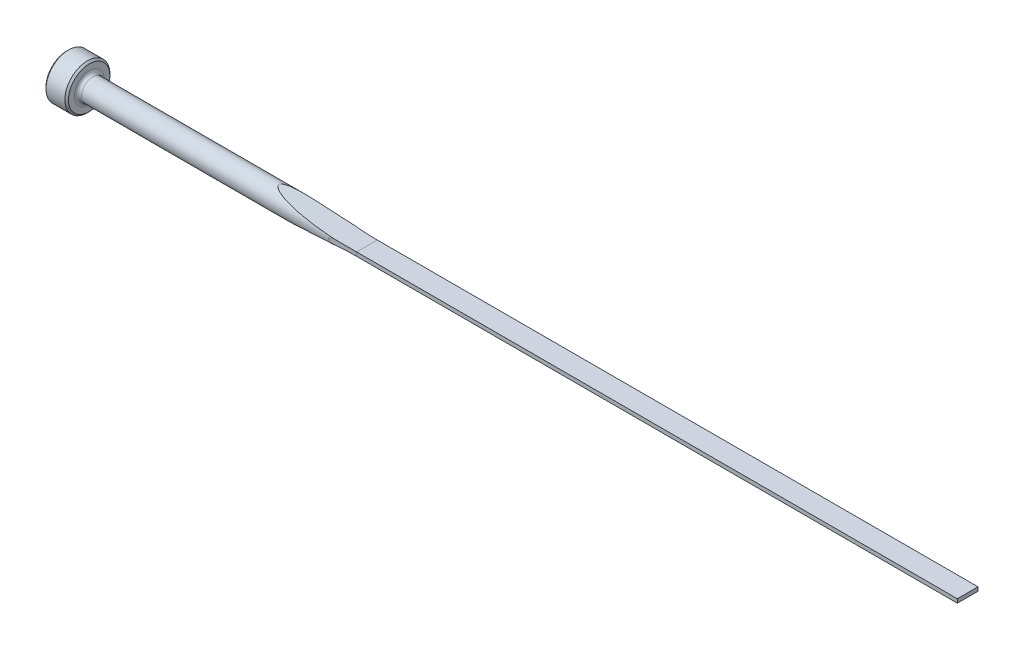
SolidWorks part; units mm, degrees
ref_plane "Front Plane" through (0, 0, 0) normal (0, 0, 1) x (1, 0, 0)
ref_plane "Top Plane" through (0, 0, 0) normal (0, 1, 0) x (1, 0, 0)
ref_plane "Right Plane" through (0, 0, 0) normal (1, 0, 0) x (0, 0, -1)
sketch "Sketch1" plane through (0, 0, 0) normal (0, 0, 1) x (1, 0, 0)
  line L0 (0, 0) -> (167.7268, 0) construction
  line L1 (0, 0) -> (0, 4.7625)
  line L2 (0, 4.7625) -> (4.7498, 4.7625)
  line L3 (4.7498, 4.7625) -> (4.7498, 2.3749)
  line L4 (4.7498, 2.3749) -> (190.5, 2.3749)
  line L5 (190.5, 2.3749) -> (190.5, 0)
  line L6 (190.5, 0) -> (0, 0)
  dimension "D1" = 190.5
  dimension "D2" = 9.525
  dimension "D3" = 4.7498
  dimension "D4" = 4.7498
revolve "Revolve1" add sketch "Sketch1" angle 360 about L0
sketch "Sketch2" plane through (0, 0, 0) normal (0, 0, 1) x (1, 0, 0)
  line L0 (190.5, 2.3749) -> (190.5, 0.4064)
  line L1 (190.5, -2.3749) -> (190.5, 2.3749) construction
  line L2 (190.5, 0.4064) -> (63.5, 0.4064)
  line L3 (190.5, 2.3749) -> (4.7498, 2.3749) construction
  line L4 (44.8956, 2.3749) -> (190.5, 2.3749)
  line L5 (166.0833, 0) -> (153.1705, 0) construction
  arc A0 (63.5, 0.4064) -> (44.8956, 2.3749) centre (63.5, 89.3064) cw
  dimension "D1" = 88.9
  dimension "D3" = 127
  dimension "D2" = 0.8128
  dimension "D4" = 18.6044
extrude "Cut-Extrude1" cut sketch "Sketch2" against normal through all both and the other way through all
mirror "Mirror1" about plane through (0, 0, 0) normal (0, 1, 0) of "Cut-Extrude1"
sketch "Sketch3" plane through (0, 0, 0) normal (0, 1, 0) x (1, 0, 0)
  line L0 (190.5, 2.3749) -> (190.5, 2.1844)
  line L1 (190.5, 2.3399) -> (190.5, -2.3399) construction
  line L2 (190.5, 2.1844) -> (63.5, 2.1844)
  line L3 (190.5, 2.3749) -> (4.7498, 2.3749) construction
  line L4 (57.6832, 2.3749) -> (190.5, 2.3749)
  line L5 (163.4716, 0) -> (166.2513, 0) construction
  line L6 (63.5, 2.3399) -> (63.5, -2.3399) construction
  arc A0 (63.5, 2.1844) -> (57.6832, 2.3749) centre (63.5, 91.0844) cw
  dimension "D2" = 88.9
  dimension "D1" = 4.3688
extrude "Cut-Extrude2" cut sketch "Sketch3" against normal through all both and the other way through all
mirror "Mirror2" about plane through (0, 0, 0) normal (0, 0, 1) of "Cut-Extrude2"
fillet "Fillet1" radius 0.762 1 edges at (4.7498, 0, 2.3749)
chamfer "Chamfer1" distance 0.381 angle 45 2 edges at (0, 0, 4.7625) (4.7498, 0, 4.7625)
